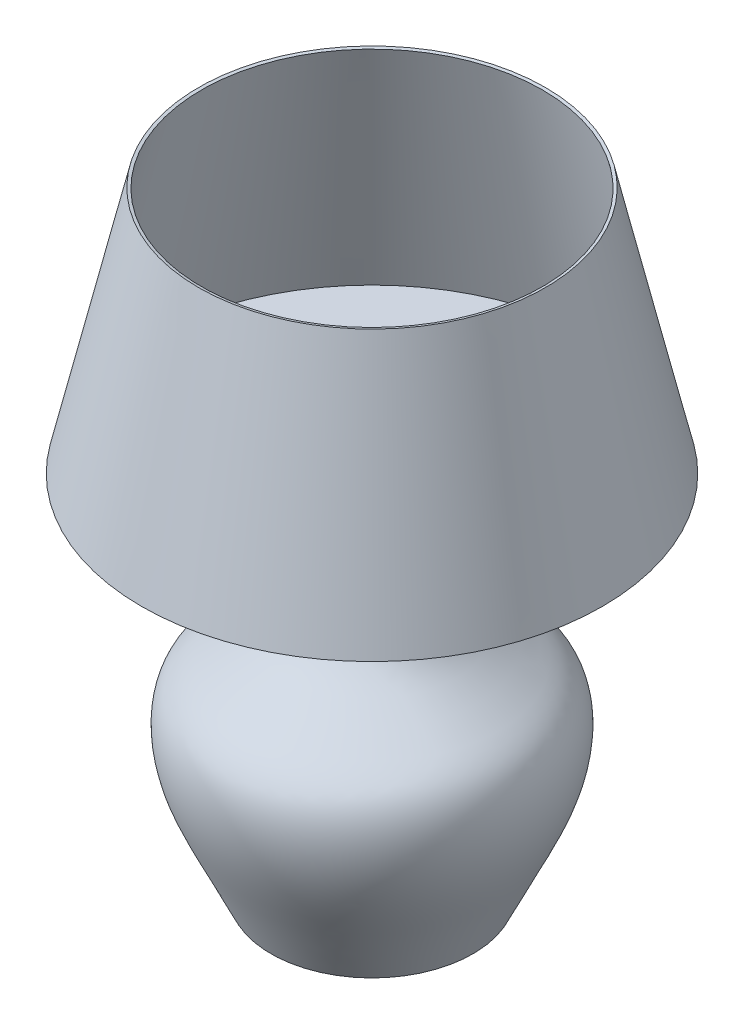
SolidWorks part; units mm, degrees
ref_plane "Płaszczyzna przednia" through (0, 0, 0) normal (0, 0, 1) x (1, 0, 0)
ref_plane "Płaszczyzna górna" through (0, 0, 0) normal (0, 1, 0) x (1, 0, 0)
ref_plane "Płaszczyzna prawa" through (0, 0, 0) normal (1, 0, 0) x (0, 0, -1)
sketch "Szkic1" plane through (0, 0, 0) normal (0, 0, 1) x (1, 0, 0)
  line L0 (369.683, 739.366) -> (1848.4151, 739.366) construction
  line L1 (1212.0078, 363.6288) -> (1110.0078, 363.6288)
  line L2 (1168.0078, 692.4687) -> (1204.5078, 692.4687)
  line L3 (1204.5078, 692.4687) -> (1204.5078, 732.4687)
  line L4 (1204.5078, 732.4687) -> (979.5078, 732.4687)
  line L5 (979.5078, 732.4687) -> (1037.0078, 982.4687)
  line L6 (1212.0078, 363.6288) -> (1212.0078, 883.3482) construction
  spline S0 degree 3 poles (1110.0078, 363.6288) (1101.8889, 380.4404) (1082.7317, 421.5222) (1050.1033, 486.2704) (1055.6613, 553.8087) (1088.2335, 572.2907) (1110.5524, 587.4528) (1147.2675, 610.6717) (1166.1011, 640.9863) (1168.0078, 692.4687) knots 0 0 0 0 0.147744 0.368083 0.519892 0.625407 0.646805 0.733868 1 1 1 1
  point P11 (0, 0)
  point P13 (0, 0)
  point P17 (0, 0)
  point P18 (0, 0)
  point P19 (1100.6675, 580.7388)
  dimension "D1" = 156.5
  dimension "D2" = 102
  dimension "D3" = 36.5
  dimension "D4" = 15
  dimension "D5" = 40
  dimension "D6" = 225
  dimension "D7" = 175
  dimension "D8" = 250
revolve "Obrót-cienka ścianka1" add sketch "Szkic1" angle 360 about L6
